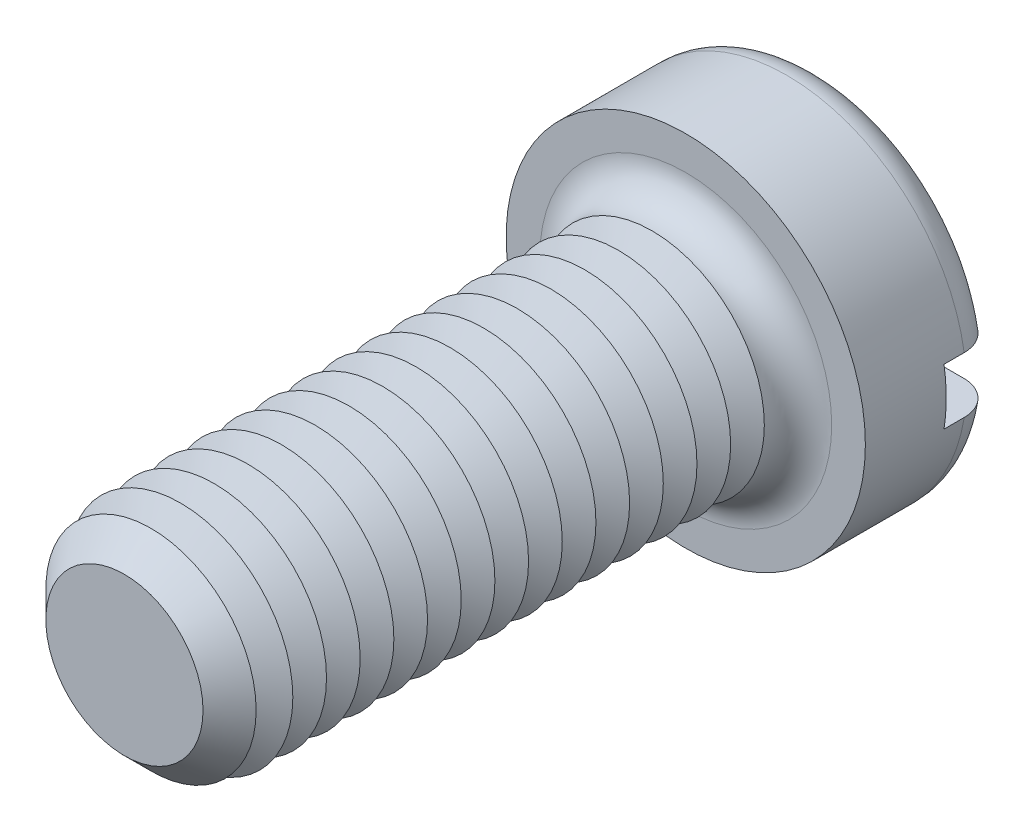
SolidWorks part; units mm, degrees
ref_plane "Front Plane" through (0, 0, 0) normal (0, 0, 1) x (1, 0, 0)
ref_plane "Top Plane" through (0, 0, 0) normal (0, 1, 0) x (1, 0, 0)
ref_plane "Right Plane" through (0, 0, 0) normal (1, 0, 0) x (0, 0, -1)
sketch "Sketch3" plane through (0, 0, 0) normal (0, 0, 1) x (1, 0, 0)
  circle A0 centre (0, 0) radius 8
  dimension "D1" = 16
extrude "Boss-Extrude2" add sketch "Sketch3" against normal blind 6
sketch "Sketch4" plane through (0, 0, 0) normal (0, 0, 1) x (1, 0, 0)
  circle A0 centre (0, 0) radius 5
  dimension "D1" = 10
extrude "Boss-Extrude3" add sketch "Sketch4" along normal blind 25
fillet "Fillet1" radius 1.5 2 edges at (8, 0, -6) (5, 0, 0)
chamfer "Chamfer1" distance 1.5 angle 45 1 edges at (5, 0, 25)
sketch "Sketch5" plane through (0, 0, 0) normal (1, 0, 0) x (0, 0, -1)
  line L0 (1.6944, 0) -> (-7.6738, 0) construction
sketch "Sketch6" plane through (0, 0, 0) normal (1, 0, 0) x (0, 0, -1)
  line L0 (-1.5, 5) -> (-2.25, 3.701)
  line L1 (-2.25, 3.701) -> (-3, 5)
  line L2 (-1.5, 5) -> (-23.5, 5) construction
  line L3 (-3, 5) -> (-1.5, 5)
  dimension "D1" = 1.5
revolve "Cut-Revolve1" cut sketch "Sketch6" angle 360 about L0
pattern_linear "LPattern1" count 15 spacing 1.5 along (0, 0, 1) of "Cut-Revolve1"
sketch "Sketch8" plane through (0, 0, -6) normal (0, 0, -1) x (-1, 0, 0)
  line L1 (8, -1.25) -> (-8, -1.25)
  line L2 (8, -1.25) -> (8, 1.25)
  line L3 (8, 1.25) -> (-8, 1.25)
  line L4 (-8, -1.25) -> (-8, 1.25)
  line L5 (8, -1.25) -> (-8, 1.25) construction
  line L6 (8, 1.25) -> (-8, -1.25) construction
  point P0 (0, 0)
  dimension "D1" = 16
  dimension "D2" = 2.5
extrude "Cut-Extrude1" cut sketch "Sketch8" against normal blind 2.4
